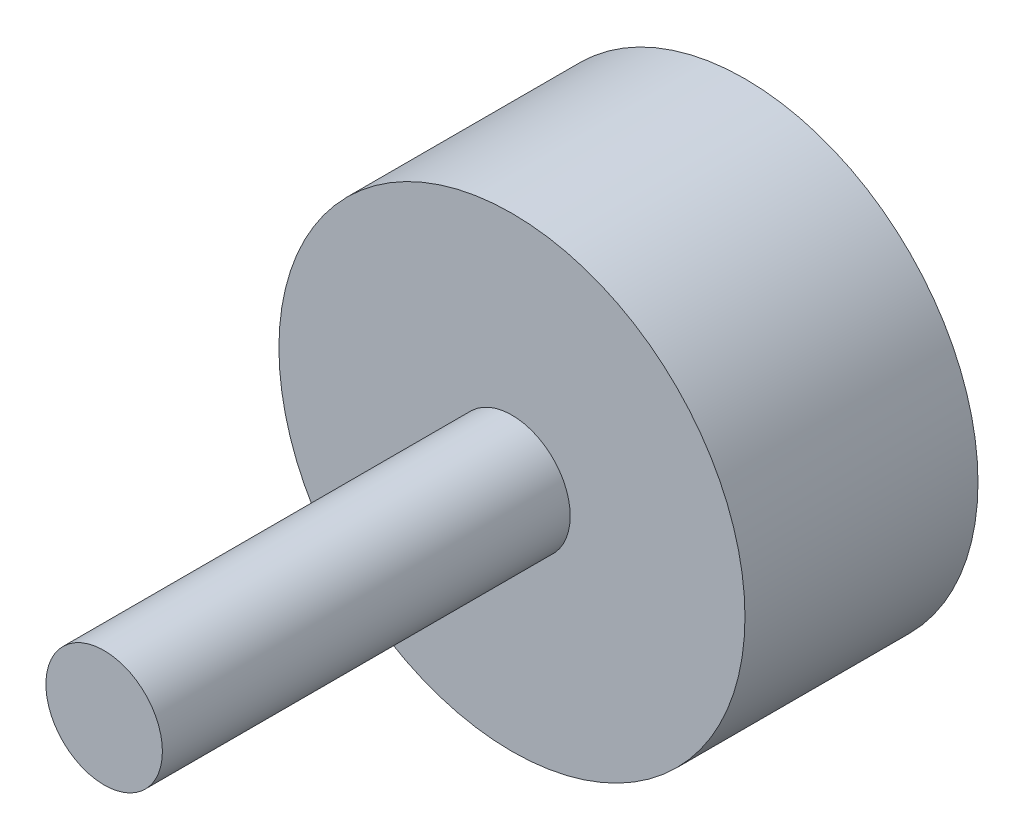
SolidWorks part; units mm, degrees
ref_plane "Front Plane" through (0, 0, 0) normal (0, 0, 1) x (1, 0, 0)
ref_plane "Top Plane" through (0, 0, 0) normal (0, 1, 0) x (1, 0, 0)
ref_plane "Right Plane" through (0, 0, 0) normal (1, 0, 0) x (0, 0, -1)
sketch "Sketch1" plane through (0, 0, 0) normal (0, 0, 1) x (1, 0, 0)
  circle A0 centre (0, 0) radius 12.7
  dimension "D1" = 25.4
extrude "Boss-Extrude1" add sketch "Sketch1" along normal blind 12.7 contours A0
sketch "Sketch2" plane through (0, 0, 12.7) normal (0, 0, 1) x (1, 0, 0)
  circle A0 centre (0, 0) radius 3.175
  dimension "D1" = 6.35
extrude "Boss-Extrude2" add sketch "Sketch2" along normal blind 22.225
